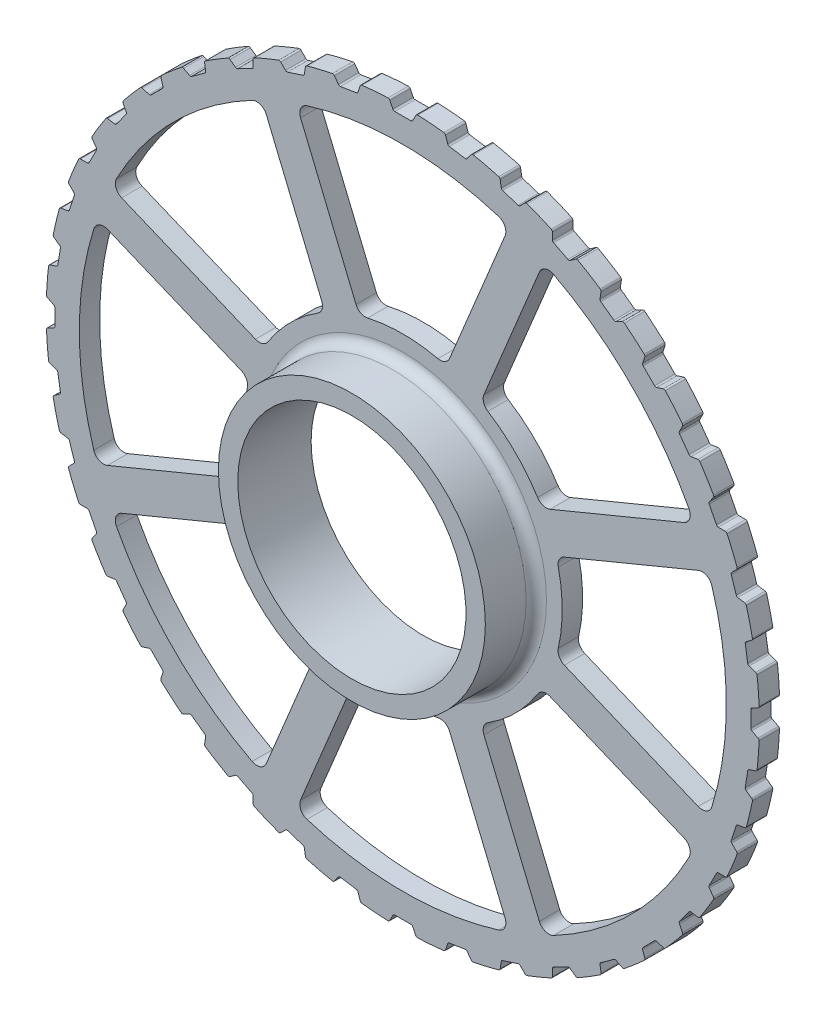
SolidWorks part; units mm, degrees
ref_plane "Plan de face" through (0, 0, 0) normal (0, 0, 1) x (1, 0, 0)
ref_plane "Plan de dessus" through (0, 0, 0) normal (0, 1, 0) x (1, 0, 0)
ref_plane "Plan de droite" through (0, 0, 0) normal (1, 0, 0) x (0, 0, -1)
sketch "Esquisse1" plane through (0, 0, 0) normal (0, 0, 1) x (1, 0, 0)
  circle A0 centre (0, 0) radius 11.1
  circle A1 centre (0, 0) radius 35
  dimension "D1" = 22.2
  dimension "D2" = 70
extrude "Boss.-Extru.1" add sketch "Esquisse1" along normal blind 2
sketch "Esquisse2" plane through (0, 0, 2) normal (0, 0, 1) x (1, 0, 0)
  circle A0 centre (0, 0) radius 13.1
  circle A1 centre (0, 0) radius 11.1 construction
  circle A2 centre (0, 0) radius 11.1
  dimension "D1" = 2
extrude "Boss.-Extru.2" add sketch "Esquisse2" along normal blind 5
sketch "Esquisse3" plane through (0, 0, 2) normal (0, 0, 1) x (1, 0, 0)
  line L0 (0, 0) -> (0, 37.2384) construction
  line L1 (-1.3378, 34.9744) -> (-0.9133, 34.1501)
  line L2 (-0.9133, 34.1501) -> (0.9133, 34.1501)
  line L3 (1.3378, 34.9744) -> (0.9133, 34.1501)
  circle A0 centre (0, 0) radius 35 construction
  arc A1 (1.3378, 34.9744) -> (-1.3378, 34.9744) centre (0, 0) ccw
  point P9 (0, 34.1501)
extrude "Enlèv. mat.-Extru.1" cut sketch "Esquisse3" against normal blind 5
fillet "Congé1" radius 0.2 4 edges at (0.9133, 34.1501, 1) (-0.9133, 34.1501, 1) (1.3378, 34.9744, 1) (-1.3378, 34.9744, 1)
pattern_circular "Répétition circulaire1" count 40 over 360 about axis through (0, 0, 0) along (0, 0, 1) of "Congé1", "Enlèv. mat.-Extru.1"
fillet "Congé2" radius 1 1 edges at (13.1, 0, 2)
sketch "Esquisse4" plane through (0, 0, 2) normal (0, 0, 1) x (1, 0, 0)
  line L0 (0, 0) -> (0, 31.3518) construction
  line L1 (-10.4478, 29.9853) -> (-4.2631, 15.0539)
  line L2 (10.4478, 29.9853) -> (4.2631, 15.0539)
  arc A0 (4.2631, 15.0539) -> (-4.2631, 15.0539) centre (0, 0) ccw
  arc A1 (10.4478, 29.9853) -> (-10.4478, 29.9853) centre (0, 0) ccw
  point P3 (-4.2631, 15.0539)
  dimension "D1" = 45
extrude "Enlèv. mat.-Extru.2" cut sketch "Esquisse4" against normal blind 5
fillet "Congé3" radius 1 4 edges at (-4.2631, 15.0539, 1) (4.2631, 15.0539, 1) (10.4478, 29.9853, 1) (-10.4478, 29.9853, 1)
pattern_circular "Répétition circulaire2" count 8 over 360 about axis through (0, 0, 0) along (0, 0, 1) of "Congé3", "Enlèv. mat.-Extru.2"
sketch "Esquisse5" plane through (0, 0, 7) normal (0, 0, 1) x (1, 0, 0)
  circle A0 centre (0, 0) radius 11.4918
extrude "Boss.-Extru.3" add sketch "Esquisse5" against normal up to surface (7 mm away)
sketch "Esquisse6" plane through (0, 0, 0) normal (0, 1, 0) x (1, 0, 0)
  line L0 (-11, 0) -> (-11.2, -7)
  line L1 (-13.1, -7) -> (13.1, -7) construction
  line L2 (-11.3056, 0) -> (-9.8004, 0) construction
  line L3 (0, 0) -> (0, -7) construction
  line L4 (0, -7) -> (-11.2, -7)
  line L5 (-11, 0) -> (0, 0)
  line L6 (0, 0) -> (0, -7)
  dimension "D1" = 22
  dimension "D2" = 22.4
revolve "Enlèvement de matière-Révolution1" cut sketch "Esquisse6" angle 360 about L3
